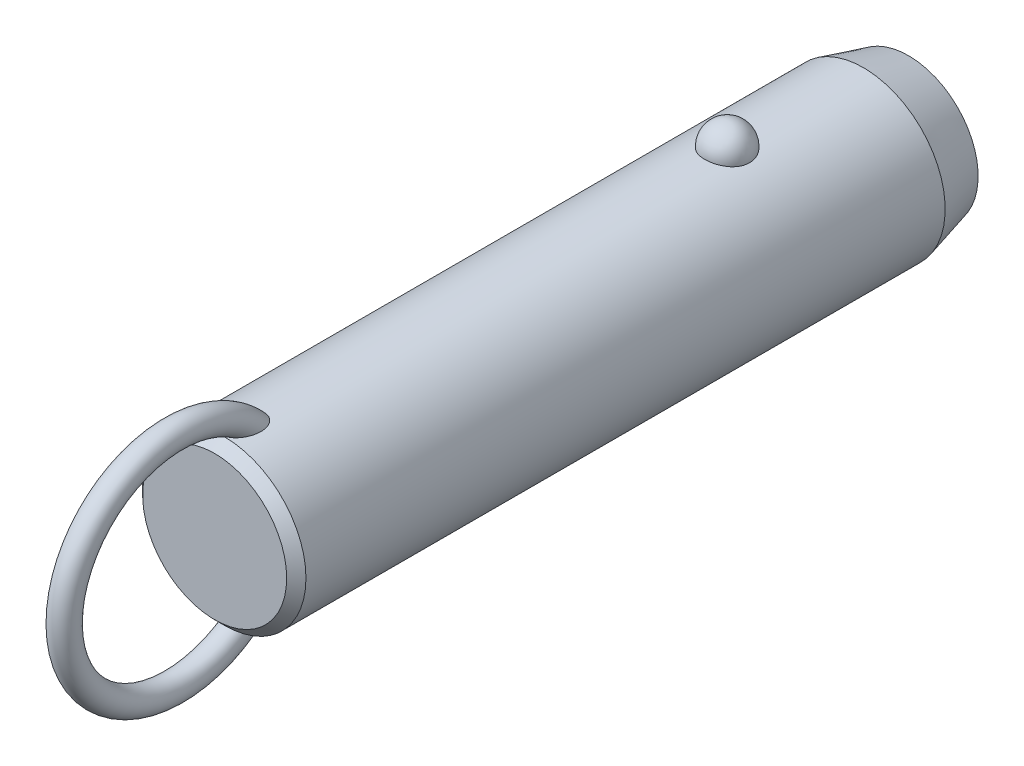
SolidWorks part; units mm, degrees
ref_plane "Front Plane" through (0, 0, 0) normal (0, 0, 1) x (1, 0, 0)
ref_plane "Top Plane" through (0, 0, 0) normal (0, 1, 0) x (1, 0, 0)
ref_plane "Right Plane" through (0, 0, 0) normal (1, 0, 0) x (0, 0, -1)
sketch "Sketch2" plane through (0, 0, 0) normal (0, 0, 1) x (1, 0, 0)
  circle A0 centre (0, 0) radius 12.7
  point P3 (0, 12.7)
  dimension "D1" = 25.4
extrude "Boss-Extrude1" add sketch "Sketch2" along normal blind 63.5
sketch "Sketch3" plane through (0, 0, 0) normal (0, 0, -1) x (-1, 0, 0)
  circle A0 centre (0, 0) radius 12.7
  dimension "D1" = 25.4
extrude "Boss-Extrude2" add sketch "Sketch3" along normal blind 31.7
chamfer "Chamfer1" distance 7 angle 15 1 edges at (-12.7, 0, -31.7)
sketch "Sketch12" plane through (0, 0, 0) normal (1, 0, 0) x (0, 0, -1)
  line L0 (-63.5, 12.7) -> (-63.5, -12.7) construction
  point P0 (-63.5, 0)
sketch "Sketch13" plane through (0, 0, 0) normal (1, 0, 0) x (0, 0, -1)
  circle A0 centre (-82.55, 0) radius 19.05
  point P2 (-63.5, 0)
  dimension "D1" = 38.1
sketch "Sketch14" plane through (0, 0, 0) normal (0, 1, 0) x (1, 0, 0)
  circle A0 centre (0, -65.5) radius 2
  point P2 (0, -63.5)
  dimension "D1" = 4
sweep "Sweep1" add profiles "Sketch14" path "Sketch13"
sketch "Sketch15" plane through (0, 0, 63.5) normal (0, 0, 1) x (1, 0, 0)
  circle A0 centre (0, 0) radius 12.7
  dimension "D1" = 25.4
extrude "Boss-Extrude3" add sketch "Sketch15" along normal blind 12.7
chamfer "Chamfer2" distance 1.5 angle 45 1 edges at (12.7, 0, 76.2)
sketch "Sketch18" plane through (0, 0, 0) normal (1, 0, 0) x (0, 0, -1)
  line L0 (24.7, 12.7) -> (-68.351, 12.7) construction
  line L1 (3.5, 16.2) -> (3.5, 9.2)
  line L2 (-68.351, -12.7) -> (24.7, -12.7) construction
  arc A0 (3.5, 16.2) -> (3.5, 9.2) centre (3.5, 12.7) ccw
  point P4 (0, 12.7)
  dimension "D1" = 28.9
revolve "Revolve1" add sketch "Sketch18" angle 360 about L1
